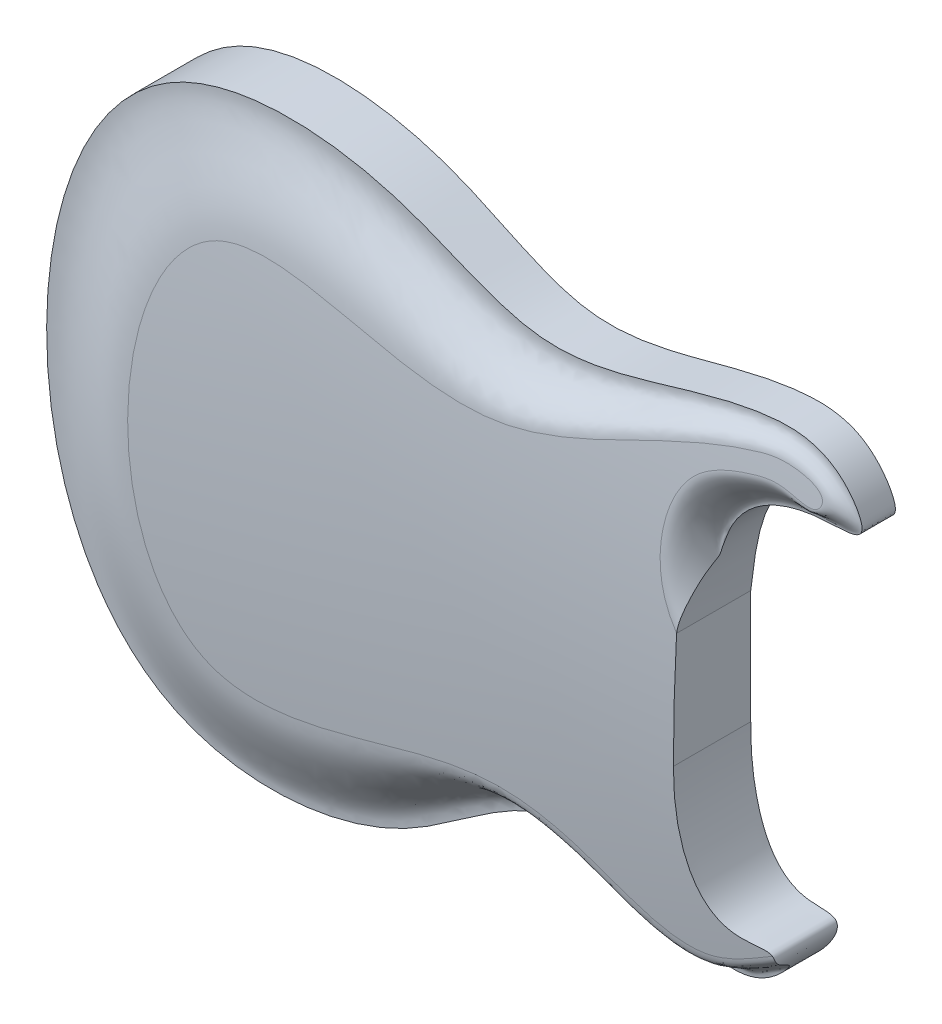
SolidWorks part; units mm, degrees
ref_plane "Front Plane" through (0, 0, 0) normal (0, 0, 1) x (1, 0, 0)
ref_plane "Top Plane" through (0, 0, 0) normal (0, 1, 0) x (1, 0, 0)
ref_plane "Right Plane" through (0, 0, 0) normal (1, 0, 0) x (0, 0, -1)
sketch "Sketch1" plane through (0, 0, 0) normal (0, 1, 0) x (1, 0, 0)
  line L0 (-380.9748, -51.9303) -> (97.4564, -30.6197) construction
  line L2 (-195.3061, 0) -> (195.3061, 0) construction
  line L3 (-592.5941, 1082.777) -> (269.486, 1121.1762) construction
  arc A0 (-380.9748, -51.9303) -> (97.4564, -30.6197) centre (-241.9267, 2207.5326) ccw
  point P2 (72.0815, -31.75)
  point P5 (-355.6, -50.8)
  dimension "D1" = 25.4
  dimension "D2" = 25.4
  dimension "D3" = 30.6197
  dimension "D4" = 97.4564
  dimension "D5" = 2.55
  dimension "D6" = 478.4312
  dimension "D7" = 12.7
  dimension "D8" = 1143
surface "Surface-Revolve1" sketch "Sketch1" parameters "D1"=30
ref_plane "Angled Plane" through (1.5542, 0, 34.8915) normal (0.0445, 0, 0.999) x (0.999, 0, -0.0445)
ref_plane "Plane1" through (0.989, 0, 22.204) normal (0.0445, 0, 0.999) x (0.999, 0, -0.0445)
sketch "Sketch2" plane through (-96.4883, 26.5703, 0) normal (0, 0, 1) x (1, 0, 0)
  line L1 (95.7101, 5.1797) -> (-196.7425, 5.1797) construction
  line L2 (-153.235, 105.762) -> (-153.235, -95.4025) construction
  line L3 (-65.0331, -89.9675) -> (-65.0331, 100.327) construction
  line L4 (-196.7425, 5.1797) -> (-260.2425, 5.1797) construction
  spline S0 degree 3 poles (207.7093, -26.5703) (148.9299, -5.4191) (71.935, 22.2868) (91.5633, 113.7917) (123.9586, 123.4584) (142.7496, 125.8642) (158.7707, 116.9684) (163.7795, 128.6124) (145.0344, 136.8672) (122.7071, 134.0197) (72.0163, 118.2186) (10.7256, 85.4574) (-70.8597, 100.4467) (-171.2577, 127.8192) (-210.7031, 4.9736) (-171.2932, -116.7149) (-66.5757, -90.9043) (-1.1762, -72.3825) (57.9574, -91.1798) (97.6769, -120.898) (155.3598, -95.4036) (183.8897, -70.5749) (207.7093, -49.8455) knots 0 0 0 0 0.128417 0.168213 0.191991 0.205462 0.220099 0.221295 0.235526 0.252941 0.284296 0.364515 0.419541 0.493426 0.585025 0.676623 0.750509 0.814713 0.847251 0.905045 0.920723 1 1 1 1
  dimension "D2" = 63.5
surface "Top Shape Trim"
sketch "Sketch3" plane through (0.989, 0, 22.204) normal (0.0445, 0, 0.999) x (0.999, 0, -0.0445)
  line L2 (29.1269, -97.8003) -> (104.2908, -52.1742) construction
  spline S1 degree 3 number of poles 252 (29.1269, -97.8003) -> (76.5867, 152.7438) construction
  spline S2 degree 3 number of poles 304 (110.6938, 8.1763) -> (104.2908, -52.1742)
  spline S3 degree 3 poles (76.5867, 152.7438) (77.0116, 152.023) (77.4158, 151.288) (78.1933, 149.7377) (78.5639, 148.9193) (79.2069, 147.255) (79.4824, 146.4068) (79.7761, 145.0925) (79.8529, 144.6501) (79.923, 143.9829) (79.9388, 143.7596) (79.9519, 143.3111) (79.9492, 143.0852) (79.9071, 142.4148) (79.8353, 141.9747) (79.5574, 141.1152) (79.3552, 140.7152) (78.8011, 139.9986) (78.4665, 139.6994) (77.7203, 139.1896) (77.3227, 138.9873) (76.4981, 138.6462) (76.0681, 138.5075) (75.2059, 138.2775) (74.7724, 138.1854) (73.467, 137.9542) (72.5904, 137.8587) (70.8312, 137.7244) (69.9485, 137.6867) (67.2957, 137.6172) (65.5204, 137.6282) (61.9713, 137.6325) (60.198, 137.626) (54.9028, 137.4324) (51.4013, 137.1025) (44.4679, 135.955) (41.0357, 135.1388) (36.8018, 133.7239) (35.9578, 133.4209) (34.2761, 132.7717) (33.4415, 132.4266) (30.978, 131.3356) (29.3812, 130.5312) (26.2852, 128.7568) (24.7861, 127.7868) (22.6175, 126.196) (21.908, 125.6431) (20.5172, 124.4895) (19.839, 123.8913) (17.8754, 122.0484) (16.6527, 120.7495) (14.3794, 118.0118) (13.3299, 116.572) (11.8745, 114.3155) (11.4091, 113.5472) (10.5158, 111.9803) (10.0891, 111.1837) (8.8743, 108.7783) (8.1462, 107.1459) (6.6995, 103.5299) (6.0067, 101.5373) (5.3859, 99.5193) knots 0.896592 0.896592 0.896592 0.896592 0.898438 0.898438 0.900391 0.900391 0.902344 0.902344 0.90332 0.90332 0.903809 0.903809 0.904297 0.904297 0.905273 0.905273 0.90625 0.90625 0.907227 0.907227 0.908203 0.908203 0.90918 0.90918 0.910156 0.910156 0.912109 0.912109 0.914063 0.914063 0.917969 0.917969 0.921875 0.921875 0.929688 0.929688 0.9375 0.9375 0.939453 0.939453 0.941406 0.941406 0.945313 0.945313 0.949219 0.949219 0.951172 0.951172 0.953125 0.953125 0.957031 0.957031 0.960938 0.960938 0.962891 0.962891 0.964844 0.964844 0.96875 0.96875 0.973375 0.973375 0.973375 0.973375 construction
  spline S4 degree 3 poles (5.3859, 99.5193) (3.3161, 93.0347) (11.5035, 51.9374) (81.5334, 21.0414) (110.6938, 8.1763) knots 0 0 0 0 0.583601 1 1 1 1 construction
sketch "Sketch4" plane through (0.989, 0, 22.204) normal (0.0445, 0, 0.999) x (0.999, 0, -0.0445)
  line L5 (110.6938, 8.1763) -> (104.2908, -52.1742)
  spline S0 degree 3 number of poles 304 (110.6938, 8.1763) -> (104.2908, -52.1742) construction
  spline S1 degree 3 number of poles 304 (110.6938, 8.1763) -> (104.2908, -52.1742)
surface "Construction Surface for Loft" sketch "Sketch4"
surface "Shape Loft"
delete or keep bodies "Body-Delete1" type delete bodies bodies 139
surface "Surface-Extend1" parameters "D1"=1.778
surface "Top Surface Knit"
sketch "Guitar Body Outline" plane through (0, 0, 0) normal (0, 0, 1) x (1, 0, 0)
  line L0 (0, 63.5) -> (0, 0)
  line L1 (0, 31.75) -> (-355.6, 31.75) construction
  line L2 (-286.0579, 184.15) -> (-286.0579, -120.65) construction
  line L3 (-163.7965, -118.8493) -> (-163.7965, 182.3493) construction
  spline S0 degree 3 poles (0, 63.5) (2.4707, 84.1763) (7.034, 122.3646) (46.8232, 139.9004) (87.3467, 136.0004) (67.0488, 173.6245) (2.0345, 177.7665) (-80.1818, 134.4451) (-173.9531, 195.6953) (-316.8898, 206.98) (-377.6823, 30.9941) (-317.9087, -140.8648) (-165.327, -137.5991) (-100.749, -67.3623) (-28.9342, -80.403) (20.3895, -123.3517) (55.7195, -68.503) (16.231, -73.6373) (1.1604, -36.0474) (0, -10.747) (0, 0) knots 0 0 0 0 0.044035 0.081332 0.096422 0.112661 0.147802 0.24108 0.300473 0.394246 0.522717 0.651187 0.744961 0.816316 0.847087 0.908535 0.926631 0.938591 0.975274 1 1 1 1
  dimension "D1" = 228.6
  dimension "D2" = 355.6
  dimension "D3" = 304.8
  dimension "D4" = 63.5
  dimension "D5" = 69.5421
extrude "Boss-Extrude1" add sketch "Guitar Body Outline" along normal blind 101.6 contours S0 L0
other "SurfaceCut1"
